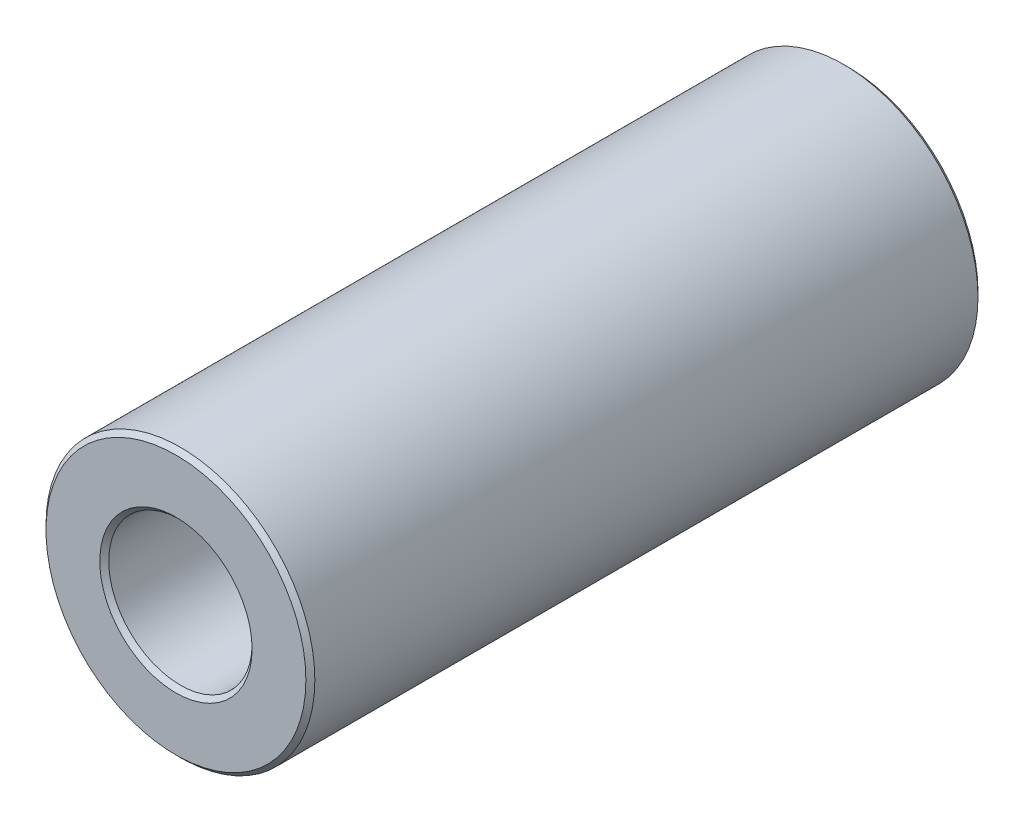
SolidWorks part; units mm, degrees
ref_plane "Front Plane" through (0, 0, 0) normal (0, 0, 1) x (1, 0, 0)
ref_plane "Top Plane" through (0, 0, 0) normal (0, 1, 0) x (1, 0, 0)
ref_plane "Right Plane" through (0, 0, 0) normal (1, 0, 0) x (0, 0, -1)
sketch "Sketch1" plane through (0, 0, 0) normal (0, 0, 1) x (1, 0, 0)
  circle A0 centre (0, 0) radius 3
  circle A1 centre (0, 0) radius 1.6
  dimension "D1" = 6
  dimension "D2" = 3.2
extrude "Boss-Extrude2" add sketch "Sketch1" along normal mid plane 15
chamfer "Chamfer3" distance 0.1 angle 45 4 edges at (3, 0, 7.5) (3, 0, -7.5) (1.6, 0, -7.5) (1.6, 0, 7.5)
